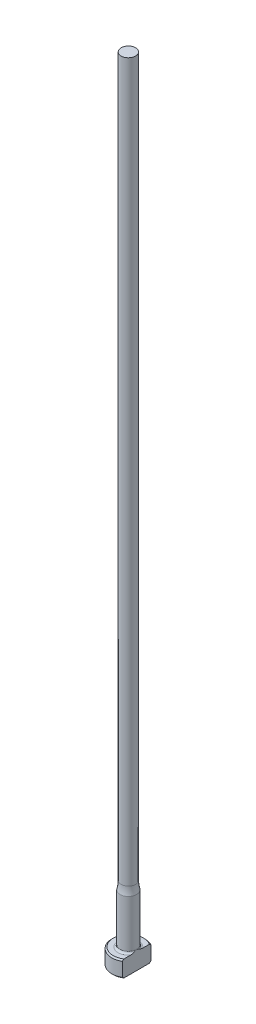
SolidWorks part; units mm, degrees
ref_plane "Front Plane" through (0, 0, 0) normal (0, 0, 1) x (1, 0, 0)
ref_plane "Top Plane" through (0, 0, 0) normal (0, 1, 0) x (1, 0, 0)
ref_plane "Right Plane" through (0, 0, 0) normal (1, 0, 0) x (0, 0, -1)
sketch "Sketch1" plane through (0, 0, 0) normal (0, 0, 1) x (1, 0, 0)
  line L0 (0, 259.9588) -> (0, -15.1925) construction
  line L1 (0, 0) -> (-3.175, 0)
  line L2 (-3.175, 0) -> (-3.175, 3.175)
  line L3 (-3.175, 3.175) -> (-1.5875, 3.175)
  line L4 (-1.3881, 14.2788) -> (-1.3881, 152.4)
  line L5 (-1.3881, 152.4) -> (0, 152.4)
  line L6 (0, 152.4) -> (0, 0)
  line L7 (-1.5875, 3.175) -> (-1.5875, 12.7)
  arc A0 (-1.5875, 12.7) -> (-1.3881, 14.2788) centre (-7.7381, 14.2788) ccw
  point P13 (-1.5875, 0)
  dimension "D1" = 6.35
  dimension "L" = 152.4
  dimension "D2" = 3.175
  dimension "H" = 6.35
  dimension "T" = 3.175
  dimension "D" = 2.7762
  dimension "S" = 12.7
revolve "Revolve1" add sketch "Sketch1" angle 360 about L0
chamfer "Chamfer1" distance 0.254 angle 45 2 edges at (0, 3.175, 3.175) (0, 0, 3.175)
fillet "Fillet1" radius 0.381 1 edges at (0, 3.175, 1.5875)
sketch "Sketch2" plane through (0, 0, 0) normal (0, 1, 0) x (1, 0, 0)
  line L0 (1.5875, -2.7496) -> (1.5875, 2.7496)
  circle A0 centre (0, 0) radius 3.175 construction
  arc A2 (1.5875, -2.7496) -> (1.5875, 2.7496) centre (0, 0) ccw
  circle A3 centre (0, 0) radius 3.175 construction
  circle A4 centre (0, 0) radius 1.5875 construction
extrude "Key Head" cut sketch "Sketch2" along normal up to next
